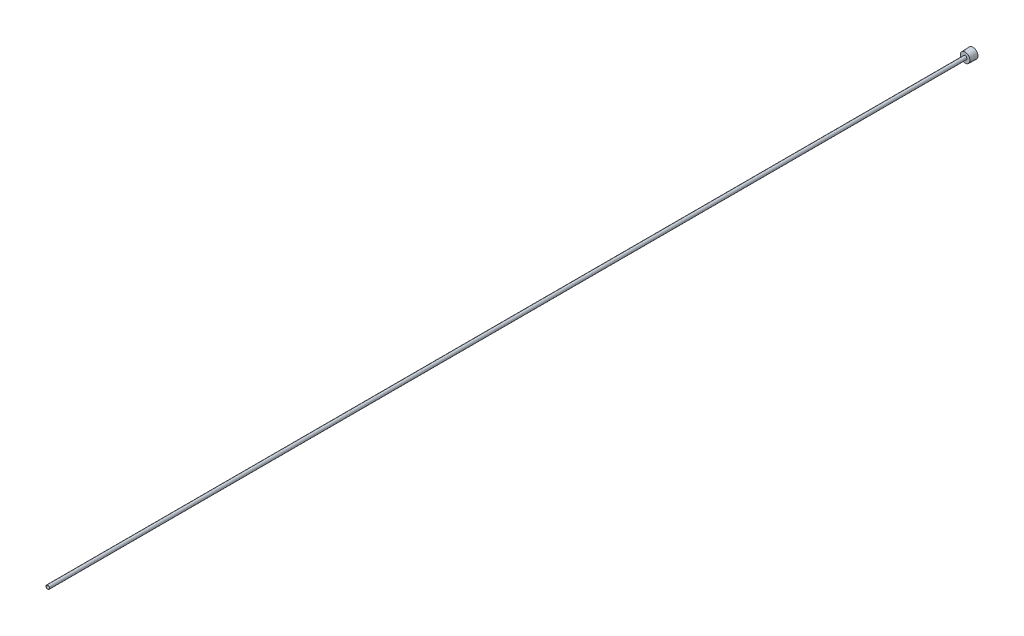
SolidWorks part; units mm, degrees
ref_plane "Front Plane" through (0, 0, 0) normal (0, 0, 1) x (1, 0, 0)
ref_plane "Top Plane" through (0, 0, 0) normal (0, 1, 0) x (1, 0, 0)
ref_plane "Right Plane" through (0, 0, 0) normal (1, 0, 0) x (0, 0, -1)
sketch "Sketch1" plane through (0, 0, 0) normal (1, 0, 0) x (0, 0, -1)
  line L0 (-331.1242, 0) -> (49668.8758, 0) construction
  line L1 (0, 0) -> (-1219.2, 0)
  line L6 (0, 0) -> (0, 6.7183)
  line L7 (0, 6.7183) -> (-10.3124, 6.3421)
  line L8 (-10.3124, 2.3749) -> (-1219.2, 2.3749)
  line L9 (-10.3124, 6.3421) -> (-10.3124, 2.3749)
  line L10 (-1219.2, 2.3749) -> (-1219.2, 0)
  dimension "D1" = 4.7498
  dimension "D2" = 10.3124
  dimension "D3" = 2.089
  dimension "D4" = 13.4366
  dimension "D5" = 1219.2
revolve "Revolve1" add sketch "Sketch1" angle 360 about L0
sketch "Sketch2" plane through (0, 0, 1219.2) normal (0, 0, 1) x (1, 0, 0)
  circle A0 centre (0, 0) radius 2.1209
  dimension "D1" = 4.2418
extrude "Cut-Extrude1" cut sketch "Sketch2" against normal through all
sketch "Sketch3" plane through (0, 0, 0) normal (0, 0, -1) x (-1, 0, 0)
  line L0 (0, 7.3901) -> (0, -7.3901) construction
  line L1 (-3.175, -1.8331) -> (0, -3.6662)
  line L2 (0, -3.6662) -> (3.175, -1.8331)
  line L3 (3.175, -1.8331) -> (3.175, 1.8331)
  line L4 (3.175, 1.8331) -> (0, 3.6662)
  line L5 (0, 3.6662) -> (-3.175, 1.8331)
  line L6 (-3.175, 1.8331) -> (-3.175, -1.8331)
  circle A0 centre (0, 0) radius 3.175 construction
  dimension "D1" = 6.35
extrude "Cut-Extrude2" cut sketch "Sketch3" against normal blind 6.35
